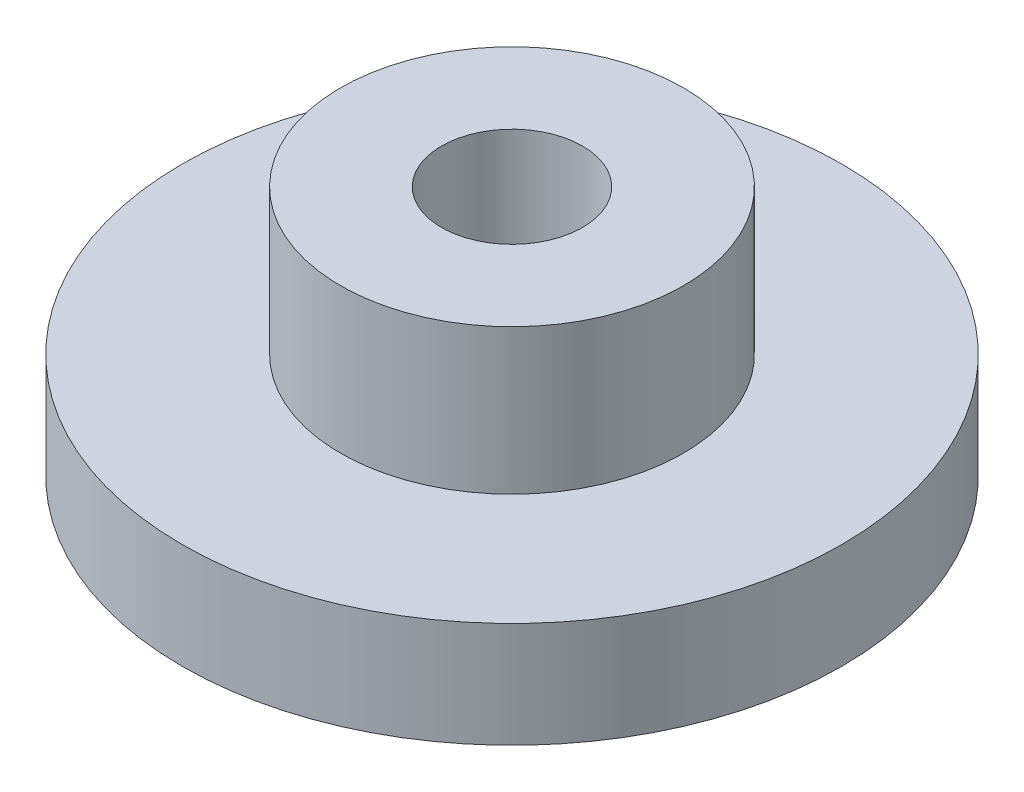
SolidWorks part; units mm, degrees
ref_plane "Спереди" through (0, 0, 0) normal (0, 0, 1) x (1, 0, 0)
ref_plane "Сверху" through (0, 0, 0) normal (0, 1, 0) x (1, 0, 0)
ref_plane "Справа" through (0, 0, 0) normal (1, 0, 0) x (0, 0, -1)
sketch "Эскиз1" plane through (0, 0, 0) normal (0, 0, 1) x (1, 0, 0)
  line L0 (2.675, 0) -> (6.5, 0)
  line L1 (6.5, 0) -> (6.5, -5.5)
  line L2 (6.5, -5.5) -> (12.5, -5.5)
  line L3 (12.5, -5.5) -> (12.5, -9.5)
  line L4 (12.5, -9.5) -> (2.675, -9.5)
  line L5 (2.675, 0) -> (2.675, -9.5)
  line L6 (0, 0) -> (0, 7.6651) construction
  dimension "D1" = 5.35
  dimension "D2" = 5.5
  dimension "D3" = 13
  dimension "D4" = 4
  dimension "D5" = 25
revolve "Повернуть1" add sketch "Эскиз1" angle 360 about L6
chamfer "Фаска1" distance 3 angle 45 1 edges at (0, -9.5, -2.675)
